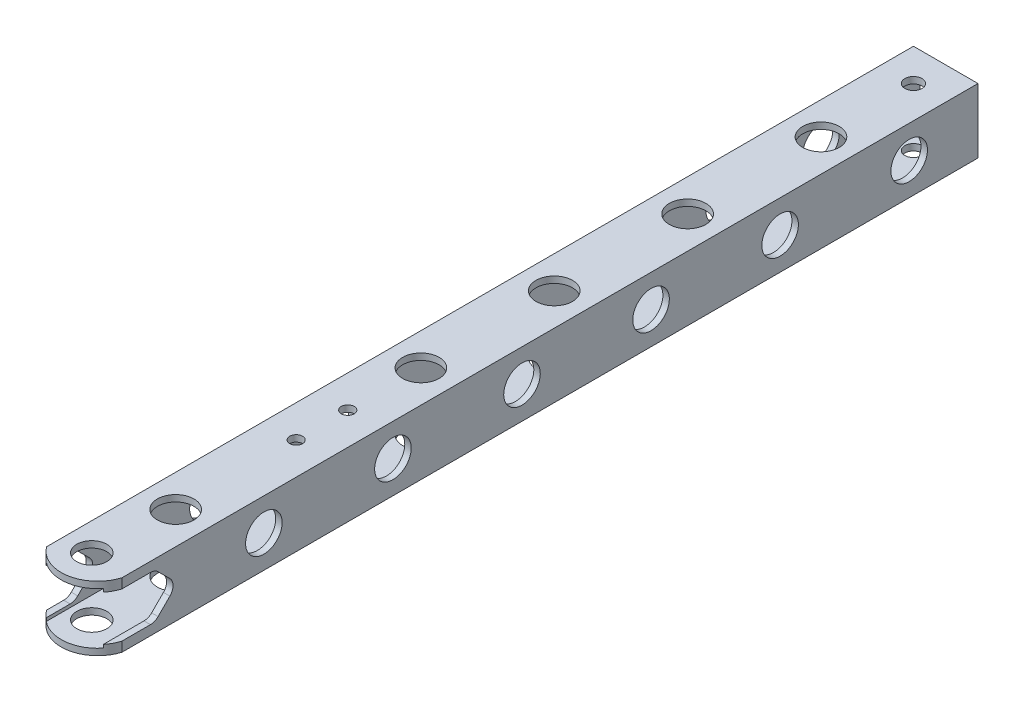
SolidWorks part; units mm, degrees
ref_plane "Plan de face" through (0, 0, 0) normal (0, 0, 1) x (1, 0, 0)
ref_plane "Plan de dessus" through (0, 0, 0) normal (0, 1, 0) x (1, 0, 0)
ref_plane "Plan de droite" through (0, 0, 0) normal (1, 0, 0) x (0, 0, -1)
sketch "Esquisse1" plane through (0, 0, 0) normal (0, 0, 1) x (1, 0, 0)
  line L0 (0, 39.806) -> (0, -43.4691) construction
  line L1 (-15, 15) -> (15, 15)
  line L2 (-15, 15) -> (-15, -15)
  line L3 (-15, -15) -> (15, -15)
  line L4 (15, 15) -> (15, -15)
  line L8 (-12, 12) -> (12, 12)
  line L9 (-27.2321, 0) -> (21.6096, 0) construction
  line L10 (0, 0) -> (-190, 0) construction
  line L11 (-12, 12) -> (-12, -12)
  line L12 (-12, -12) -> (12, -12)
  line L13 (12, 12) -> (12, -12)
  dimension "D1" = 30
  dimension "D2" = 24
extrude "Extrusion1" add sketch "Esquisse1" along normal blind 395 and the other way blind 15
sketch "Esquisse2" plane through (0, 15, 0) normal (0, 1, 0) x (-1, 0, 0)
  line L0 (0, 380) -> (0, 0) construction
  circle A0 centre (0, 43) radius 8.5
  dimension "D1" = 17
  dimension "D2" = 43
extrude "Enlèv. mat.-Extru.1" cut sketch "Esquisse2" against normal through all
pattern_linear "Répétition linéaire4" count 4 spacing 62 along (0, 0, 1) of "Enlèv. mat.-Extru.1"
sketch "Esquisse5" plane through (0, 15, 0) normal (0, 1, 0) x (-1, 0, 0)
  line L0 (0, 380) -> (0, 0) construction
  circle A0 centre (0, 343) radius 8.5
  circle A1 centre (0, 229) radius 8.5 construction
  circle A2 centre (0, 43) radius 8.5 construction
  dimension "D1" = 300
extrude "Enlèv. mat.-Extru.4" cut sketch "Esquisse5" against normal through all
sketch "Esquisse4" plane through (15, 0, 0) normal (1, 0, 0) x (0, 0, -1)
  line L0 (15, -15) -> (15, 15) construction
  circle A0 centre (-17, 0) radius 8.5
  dimension "D2" = 17
  dimension "D1" = 32
extrude "Enlèv. mat.-Extru.3" cut sketch "Esquisse4" against normal up to next
pattern_linear "Répétition linéaire5" count 6 spacing 60 along (0, 0, 1) of "Enlèv. mat.-Extru.3"
sketch "Esquisse3" plane through (-15, 0, 0) normal (-1, 0, 0) x (0, 0, 1)
  line L0 (380, 0) -> (0, 0) construction
  line L1 (-15, 15) -> (-15, -15) construction
  circle A0 centre (31, 0) radius 8.5
  dimension "D1" = 17
  dimension "D2" = 46
extrude "Enlèv. mat.-Extru.2" cut sketch "Esquisse3" against normal up to next
sketch "Esquisse6" plane through (-15, 0, 0) normal (-1, 0, 0) x (0, 0, 1)
  line L0 (380, 0) -> (0, 0) construction
  circle A0 centre (76, 0) radius 8.5
  circle A1 centre (31, 0) radius 8.5 construction
  dimension "D1" = 45
extrude "Enlèv. mat.-Extru.5" cut sketch "Esquisse6" against normal up to next
pattern_linear "Répétition linéaire6" count 5 spacing 60 along (0, 0, 1) of "Enlèv. mat.-Extru.5"
hole_wizard "Dégagement M61" positions "Esquisse8" profile "Esquisse7" hole size "M6" standard "ISO"
sketch "Esquisse8" plane through (0, 15, 0) normal (0, 1, 0) x (-1, 0, 0)
  line L0 (0, 380) -> (0, 0) construction
  circle A6 centre (0, 263) radius 3.3 construction
  circle A7 centre (0, 287) radius 3.3 construction
  point P1 (0, 263)
  point P2 (0, 287)
sketch "Esquisse7" plane through (0, 15, 263) normal (1, 0, 0) x (0, 0, 1)
  line L0 (0, 0) -> (0, 30)
  line L1 (0, 30) -> (3, 30)
  line L2 (3, 30) -> (3, 0)
  line L5 (3, 0) -> (0, 0)
  line L11 (0, -6.35) -> (0, 107.95) construction
  dimension "Diamètre du perçage jusqu'au prochain" = 6
  dimension "Profondeur du perçage jusqu'au prochain" = 30
sketch "Esquisse9" plane through (0, 15, 0) normal (0, 1, 0) x (-1, 0, 0)
  circle A0 centre (2, 380) radius 7
  dimension "D1" = 14
extrude "Enlèv. mat.-Extru.6" cut sketch "Esquisse9" against normal through all
sketch "Esquisse10" plane through (0, 15, 0) normal (0, 1, 0) x (-1, 0, 0)
  line L2 (-15, 395) -> (-15, -15) construction
  line L3 (15, 395) -> (15, -15) construction
  line L4 (-15, 395) -> (15, 395) construction
  line L5 (-15, 383) -> (-15, 396)
  line L6 (15, 388) -> (15, 396)
  line L7 (-15, 396) -> (15, 396)
  arc A0 (-15, 383) -> (15, 388) centre (1.2506, 377.9966) cw
  dimension "D1" = 7
  dimension "D2" = 12
  dimension "D3" = 1
extrude "Enlèv. mat.-Extru.7" cut sketch "Esquisse10" against normal through all
sketch "Esquisse11" plane through (-15, 0, 0) normal (-1, 0, 0) x (0, 0, 1)
  line L0 (395.5358, 0) -> (356.9318, 0) construction
  line L2 (380, 0) -> (0, 0) construction
  line L3 (391.171, 10.5) -> (378, 10.5)
  line L4 (391.171, -12) -> (391.171, 12) construction
  line L5 (378, 10.5) -> (367.5, 0)
  line L6 (367.5, 0) -> (378, -10.5)
  line L7 (378, -10.5) -> (391.171, -10.5)
  line L8 (391.171, -10.5) -> (391.171, 10.5)
  line L9 (388, -15) -> (388, 15) construction
  dimension "D1" = 21
  dimension "D2" = 10
extrude "Enlèv. mat.-Extru.8" cut sketch "Esquisse11" against normal up to surface (3 mm away)
sketch "Esquisse12" plane through (15, 0, 0) normal (1, 0, 0) x (0, 0, -1)
  line L0 (-388.652, 0) -> (-340.2686, 0) construction
  line L1 (-388.652, 12) -> (-388.652, -12) construction
  line L2 (-380, 0) -> (0, 0) construction
  line L3 (-388.652, -10.5) -> (-367.652, -10.5)
  line L4 (-367.652, -10.5) -> (-357.152, 0)
  line L5 (-357.152, 0) -> (-367.652, 10.5)
  line L6 (-367.652, 10.5) -> (-388.652, 10.5)
  line L7 (-378, -10.5) -> (-391.171, -10.5) construction
  line L8 (-388.652, -10.5) -> (-388.652, 10.5)
  dimension "D1" = 21
extrude "Enlèv. mat.-Extru.9" cut sketch "Esquisse12" against normal up to next
fillet "Congé1" radius 5 6 edges at (-13.5, -10.5, 378) (13.5, -10.5, 367.652) (13.5, 10.5, 367.652) (13.5, 0, 357.152) (-13.5, 0, 367.5) (-13.5, 10.5, 378)
sketch "Esquisse13" plane through (0, 15, 0) normal (0, 1, 0) x (-1, 0, 0)
  circle A0 centre (0, 0) radius 4
  dimension "D1" = 8
extrude "Enlèv. mat.-Extru.10" cut sketch "Esquisse13" against normal through all
